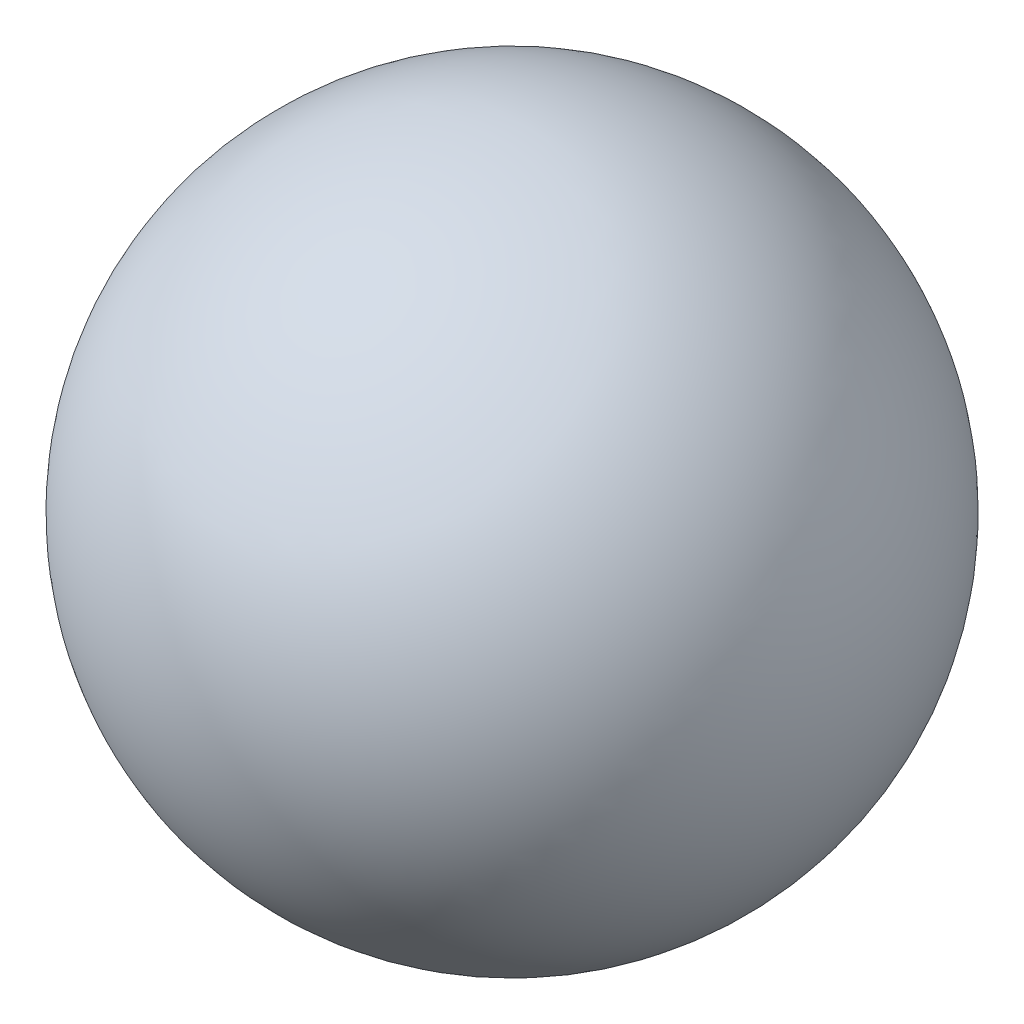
SolidWorks part; units mm, degrees
ref_plane "Front Plane" through (0, 0, 0) normal (0, 0, 1) x (1, 0, 0)
ref_plane "Top Plane" through (0, 0, 0) normal (0, 1, 0) x (1, 0, 0)
ref_plane "Right Plane" through (0, 0, 0) normal (1, 0, 0) x (0, 0, -1)
sketch "Sketch1" plane through (0, 0, 0) normal (0, 1, 0) x (1, 0, 0)
  line L0 (0, 0) -> (0, 12.7) construction
  line L1 (0, 12.7) -> (0, 0)
  arc A0 (0, 12.7) -> (0, 0) centre (0, 6.35) cw
  dimension "D1" = 12.7
revolve "Revolve1" add sketch "Sketch1" angle 360 about L0
